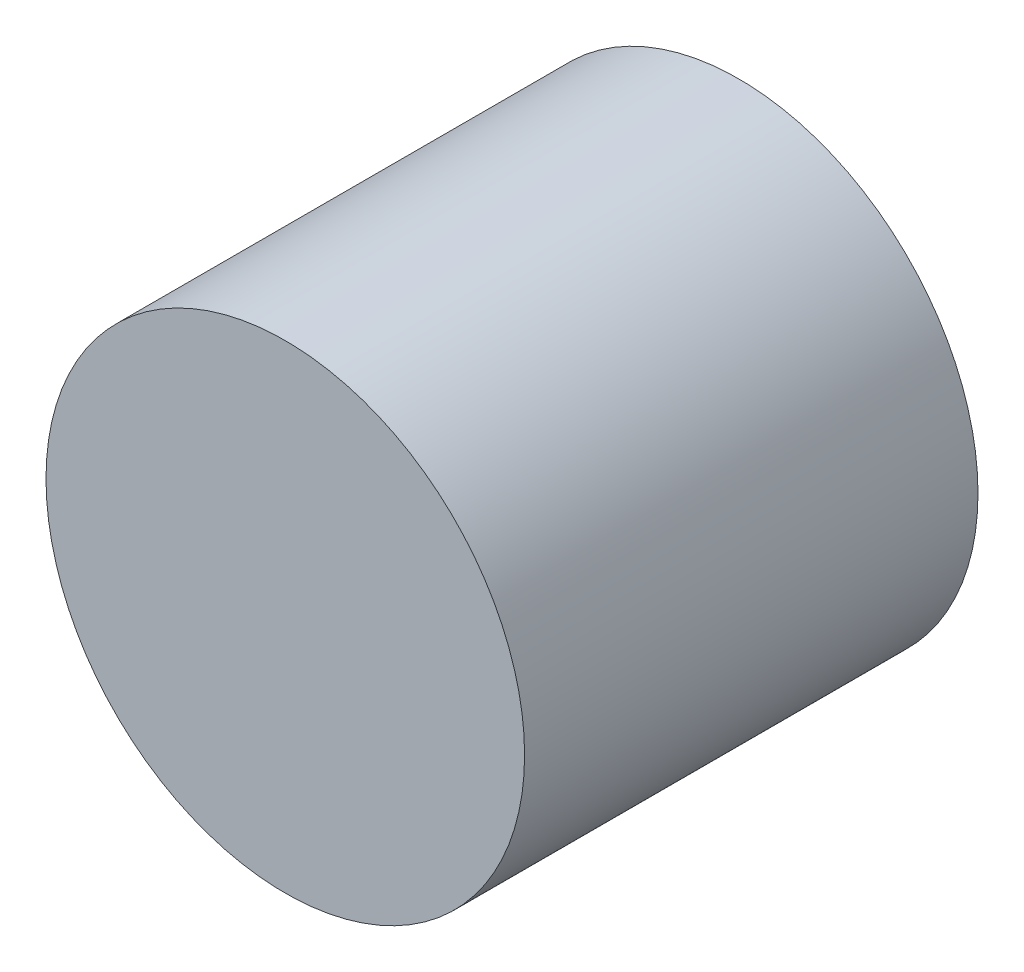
SolidWorks part; units mm, degrees
ref_plane "Front" through (0, 0, 0) normal (0, 0, 1) x (1, 0, 0)
ref_plane "Top" through (0, 0, 0) normal (0, 1, 0) x (1, 0, 0)
ref_plane "Right" through (0, 0, 0) normal (1, 0, 0) x (0, 0, -1)
sketch "Sketch1" plane through (0, 0, 0) normal (0, 0, 1) x (1, 0, 0)
  circle A0 centre (0, 0) radius 19
  dimension "D1" = 38
extrude "Base-Extrude" add sketch "Sketch1" along normal blind 36
scale "Scale1" scale about centroid uniform scaling yes scale factor 2.5
scale "Scale2" scale about centroid uniform scaling yes scale factor 1.2
